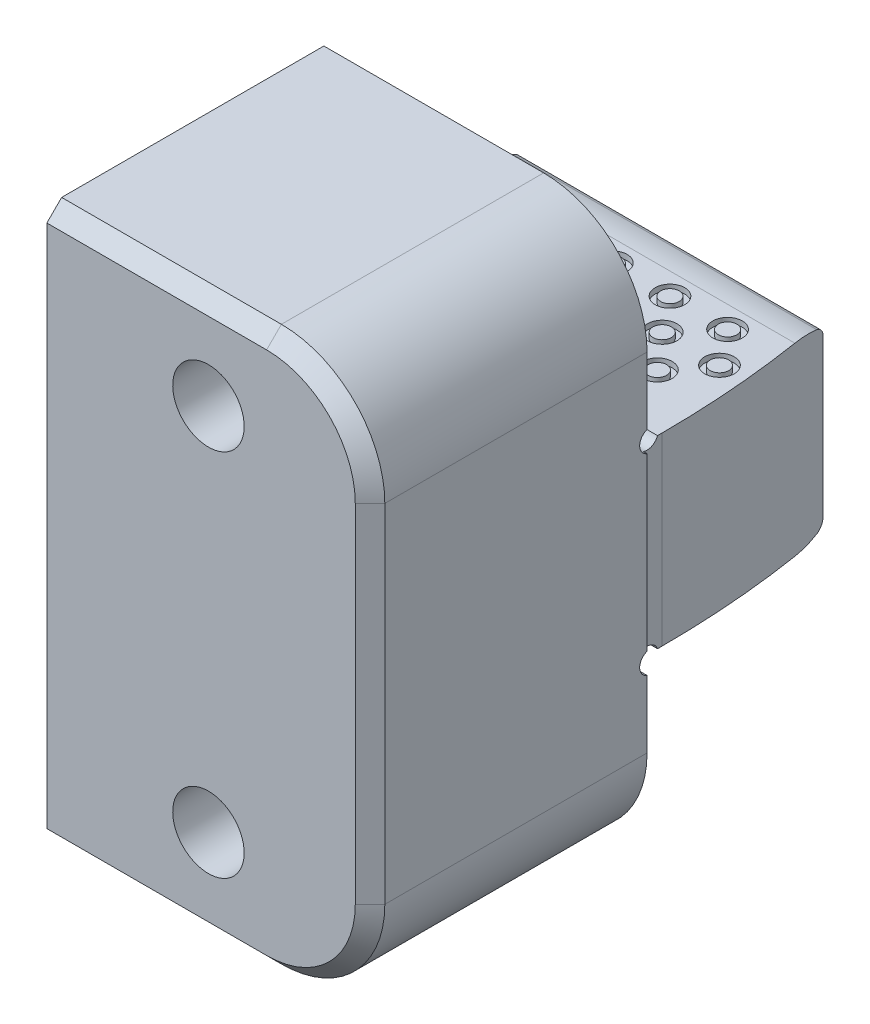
SolidWorks part; units mm, degrees
ref_plane "Front Plane" through (0, 0, 0) normal (0, 0, 1) x (1, 0, 0)
ref_plane "Top Plane" through (0, 0, 0) normal (0, 1, 0) x (1, 0, 0)
ref_plane "Right Plane" through (0, 0, 0) normal (1, 0, 0) x (0, 0, -1)
sketch "Sketch3" plane through (0, 0, 0) normal (1, 0, 0) x (0, 0, -1)
  line L0 (0, 12.2238) -> (0, -12.2238) construction
  line L1 (-19.05, -19.05) -> (0, -19.05)
  line L2 (-19.05, -19.05) -> (-19.05, 19.05)
  line L3 (-19.05, 19.05) -> (0, 19.05)
  line L4 (13.5636, -6.3475) -> (13.5636, 6.3475)
  line L6 (0, -19.05) -> (0, -6.3475)
  line L7 (0, -6.3475) -> (13.5636, -6.3475)
  line L8 (0, 19.05) -> (0, 6.3475)
  line L9 (0, 6.3475) -> (13.5636, 6.3475)
  line L10 (0, 0) -> (50000, 0) construction
  dimension "D1" = 32.6136
  dimension "D2" = 19.05
  dimension "D3" = 38.1
  dimension "D4" = 12.6949
extrude "Extrude1" add sketch "Sketch3" along normal mid plane 22.225
sketch "Sketch7" plane through (11.1125, 0, 0) normal (1, 0, 0) x (0, 0, -1)
  line L1 (0, -14.5526) -> (21.9683, -14.5526)
  line L2 (0, -14.5526) -> (0, 17.1683)
  line L3 (0, 17.1683) -> (21.9683, 17.1683)
  line L4 (21.9683, -14.5526) -> (21.9683, 17.1683)
  line L5 (0, -19.05) -> (0, -6.3475) construction
extrude "Cut-Extrude3" cut sketch "Sketch7" against normal blind 0.254
sketch "Sketch8" plane through (11.1125, 0, 0) normal (1, 0, 0) x (0, 0, -1)
  line L0 (0, 0) -> (50000, 0) construction
  line L1 (0, -19.05) -> (0, 19.05) construction
  line L2 (0, 6.3475) -> (13.5636, 6.3475) construction
  circle A0 centre (0.254, 6.6015) radius 0.762
  circle A1 centre (0.254, -6.6015) radius 0.762
  dimension "D1" = 0.762
  dimension "D2" = 0.508
  dimension "D3" = 0.508
extrude "Cut-Extrude4" cut sketch "Sketch8" against normal through all
sketch "Sketch9" plane through (11.1125, 0, 0) normal (1, 0, 0) x (0, 0, -1)
  line L0 (0.9724, 6.3475) -> (13.5636, 6.3475) construction
  line L1 (13.5636, 6.3475) -> (13.5636, -6.3475) construction
  line L2 (0, 0) -> (50000, 0) construction
  line L3 (13.5636, 5.3514) -> (17.5514, 5.3514)
  line L4 (11.2014, 6.3475) -> (11.2014, 11.7014)
  line L5 (11.2014, 11.7014) -> (17.5514, 11.7014)
  line L6 (17.5514, 5.3514) -> (17.5514, 11.7014)
  line L7 (17.5514, -5.3514) -> (17.5514, -11.7014)
  line L8 (11.2014, -11.7014) -> (17.5514, -11.7014)
  line L9 (11.2014, -6.3475) -> (11.2014, -11.7014)
  line L10 (13.5636, -5.3514) -> (17.5514, -5.3514)
  arc A0 (11.2014, 6.3475) -> (13.0198, 6.0815) centre (11.2014, -0.0025) cw
  arc A1 (13.0198, 6.0815) -> (13.5636, 5.3514) centre (12.8016, 5.3514) cw
  arc A2 (13.0198, -6.0815) -> (13.5636, -5.3514) centre (12.8016, -5.3514) ccw
  arc A3 (11.2014, -6.3475) -> (13.0198, -6.0815) centre (11.2014, 0.0025) ccw
  dimension "D1" = 0.762
  dimension "D2" = 6.35
  dimension "D3" = 2.3622
  dimension "D4" = 6.35
  dimension "D5" = 6.35
extrude "Cut-Extrude5" cut sketch "Sketch9" against normal through all
sketch "Sketch13" plane through (0, 19.05, 0) normal (0, 1, 0) x (1, 0, 0)
  line L0 (10.8585, 0.9724) -> (10.8585, 11.2014) construction
  line L2 (9.5755, 13.97) -> (22.2755, 13.97)
  line L4 (10.8585, 1.27) -> (22.2755, 1.27)
  line L5 (22.2755, 13.97) -> (22.2755, 1.27)
  arc A0 (9.5755, 13.97) -> (10.8585, 1.27) centre (-52.6415, 1.27) cw
  dimension "D1" = 63.5
  dimension "D2" = 1.27
  dimension "D3" = 12.7
  dimension "D4" = 12.7
extrude "Cut-Extrude6" cut sketch "Sketch13" against normal through all
sketch "Sketch15" plane through (0, 6.3475, 0) normal (0, 1, 0) x (1, 0, 0)
  line L0 (11.1125, -19.05) -> (-11.1125, -19.05) construction
  line L1 (-11.1125, 11.2014) -> (-11.1125, 0.9724) construction
  circle A0 centre (-4.9403, 9.7028) radius 1.016
  circle A1 centre (-4.9403, 9.7028) radius 0.635
  circle A2 centre (-0.9779, 9.7028) radius 1.016
  circle A3 centre (-0.9779, 9.7028) radius 0.635
  circle A4 centre (-8.9027, 9.7028) radius 1.016
  circle A5 centre (-8.9027, 9.7028) radius 0.635
  circle A6 centre (2.9845, 9.7028) radius 1.016
  circle A7 centre (2.9845, 9.7028) radius 0.635
  circle A8 centre (6.9469, 9.7028) radius 1.016
  circle A9 centre (6.9469, 9.7028) radius 0.635
  circle A10 centre (-3.0099, 7.2898) radius 1.016
  circle A11 centre (-3.0099, 7.2898) radius 0.635
  circle A12 centre (0.9271, 7.2898) radius 1.016
  circle A13 centre (0.9271, 7.2898) radius 0.635
  circle A14 centre (-6.9469, 7.2898) radius 1.016
  circle A15 centre (-6.9469, 7.2898) radius 0.635
  circle A16 centre (4.8641, 7.2898) radius 1.016
  circle A17 centre (4.8641, 7.2898) radius 0.635
  circle A18 centre (8.8011, 7.2898) radius 1.016
  circle A19 centre (8.8011, 7.2898) radius 0.635
  circle A20 centre (-4.9403, 4.8768) radius 1.016
  circle A21 centre (-4.9403, 4.8768) radius 0.635
  circle A22 centre (-0.9779, 4.8768) radius 1.016
  circle A23 centre (-0.9779, 4.8768) radius 0.635
  circle A24 centre (-8.9027, 4.8768) radius 1.016
  circle A25 centre (-8.9027, 4.8768) radius 0.635
  circle A26 centre (2.9845, 4.8768) radius 1.016
  circle A27 centre (2.9845, 4.8768) radius 0.635
  circle A28 centre (6.9469, 4.8768) radius 1.016
  circle A29 centre (6.9469, 4.8768) radius 0.635
  dimension "D1" = 28.7528
  dimension "D2" = 2.413
  dimension "D12" = 3.9624
  dimension "D7" = 2.032
  dimension "D8" = 1.27
  dimension "D3" = 2.413
  dimension "D4" = 2.2098
  dimension "D5" = 4.1656
  dimension "D6" = 3.937
  dimension "D9" = 3.937
  dimension "D10" = 3.937
  dimension "D11" = 3.9624
  dimension "D13" = 3.9624
  dimension "D14" = 3.9624
  dimension "D15" = 3.937
extrude "Cut-Extrude7" cut sketch "Sketch15" against normal blind 0.381
mirror "Mirror1" about plane through (0, 0, 0) normal (0, 1, 0) of "Cut-Extrude7"
hole_wizard "#8 CBORE" positions "Sketch11" profile "Sketch10" counterbore size "#8" standard "Ansi Inch"
sketch "Sketch11" plane through (0, 0, 0) normal (0, 0, -1) x (-1, 0, 0)
  line L0 (0, 0) -> (0, 50000) construction
  line L1 (0, 0) -> (50000, 0) construction
  point P0 (0, 12.7)
  point P10 (0, -12.7)
  dimension "D1" = 25.4
sketch "Sketch10" plane through (0, 12.7, 0) normal (1, 0, 0) x (0, 1, 0)
  line L0 (0, 0) -> (0, 19.05)
  line L1 (0, 19.05) -> (2.4574, 19.05)
  line L3 (2.4574, 19.05) -> (2.4575, 4.9606)
  line L4 (2.4575, 4.9606) -> (3.9687, 4.9606)
  line L5 (3.9687, 4.9606) -> (3.9687, 0)
  line L7 (3.9687, 0) -> (0, 0)
  line L11 (0, -6.35) -> (0, 107.95) construction
  dimension "Thru Hole Dia." = 4.9149
  dimension "Thru Hole Depth" = 19.05
  dimension "C'Bore Dia." = 7.9375
  dimension "C'Bore Depth" = 4.9606
fillet "Fillet1" radius 7.112 2 edges at (11.1125, -19.05, 9.525) (11.1125, 19.05, 9.525)
chamfer "Chamfer1" distance 1.016 angle 45 5 edges at (-3.556, 19.05, 19.05) (-3.556, -19.05, 19.05) (11.1125, 0, 19.05) (9.0294, 16.9669, 19.05) (9.0294, -16.9669, 19.05)
